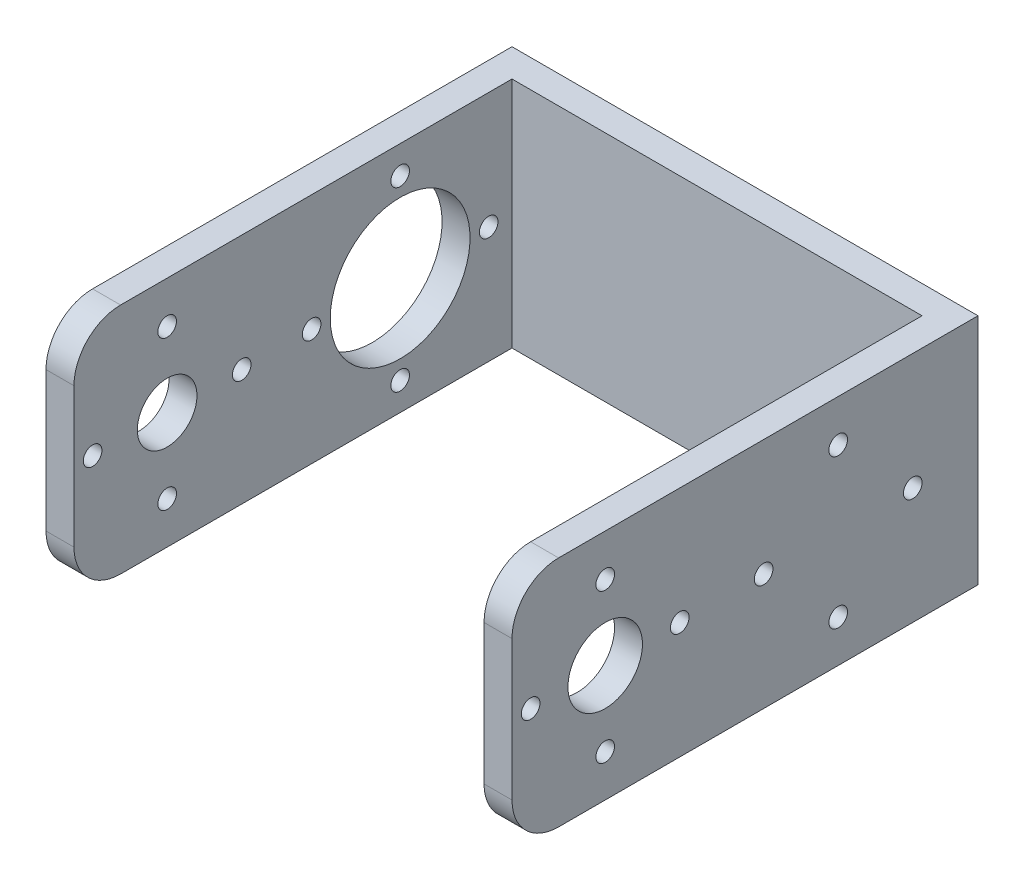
SolidWorks part; units mm, degrees
ref_plane "Front Plane" through (0, 0, 0) normal (0, 0, 1) x (1, 0, 0)
ref_plane "Top Plane" through (0, 0, 0) normal (0, 1, 0) x (1, 0, 0)
ref_plane "Right Plane" through (0, 0, 0) normal (1, 0, 0) x (0, 0, -1)
sketch "Sketch1" plane through (0, 0, 0) normal (0, 1, 0) x (1, 0, 0)
  line L0 (-23, 25) -> (27, 25)
  line L2 (27, 25) -> (27, -25)
  line L3 (27, -25) -> (24, -25)
  line L4 (24, -25) -> (24, 22)
  line L5 (24, 22) -> (-20, 22)
  line L6 (-20, 22) -> (-20, -25)
  line L7 (-20, -25) -> (-23, -25)
  line L8 (-23, -25) -> (-23, 25)
  dimension "D1" = 50
  dimension "D2" = 3
  dimension "D3" = 3
  dimension "D4" = 3
  dimension "D6" = 50
  dimension "D7" = 50
extrude "Boss-Extrude1" add sketch "Sketch1" along normal blind 25
sketch "Sketch2" plane through (-23, 0, 0) normal (-1, 0, 0) x (0, 0, 1)
  line L0 (-25, 12.5) -> (25, 12.5) construction
  line L1 (15, 25) -> (15, 0) construction
  line L2 (-25, 0) -> (25, 0) construction
  line L3 (-25, 25) -> (-25, 0) construction
  line L6 (25, 25) -> (25, 0) construction
  line L7 (-10, 25) -> (-10, 0) construction
  line L8 (-25, 25) -> (25, 25) construction
  circle A2 centre (-10, 12.5) radius 7.5
  circle A3 centre (-10, 22) radius 1
  circle A4 centre (-0.5, 12.5) radius 1
  circle A5 centre (-10, 3) radius 1
  circle A6 centre (-19.5, 12.5) radius 1
  circle A7 centre (15, 12.5) radius 3.2
  circle A8 centre (15, 20.5) radius 1
  circle A9 centre (23, 12.5) radius 1
  circle A10 centre (15, 4.5) radius 1
  circle A11 centre (7, 12.5) radius 1
  point P37 (15, 12.5)
  dimension "D2" = 15
  dimension "D3" = 15
  dimension "D8" = 6.4
  dimension "D9" = 2
  dimension "D10" = 2
  dimension "D11" = 2
  dimension "D12" = 8
  dimension "D4" = 15
  dimension "D5" = 9.5
  dimension "D6" = 10
  dimension "D7" = 9.5
  dimension "D13" = 4
extrude "Cut-Extrude1" cut sketch "Sketch2" against normal up to next
sketch "Sketch4" plane through (27, 0, 0) normal (1, 0, 0) x (0, 0, -1)
  line L0 (-25, 12.5) -> (25, 12.5) construction
  line L1 (-15, 25) -> (-15, 0) construction
  line L2 (-15, 22.5) -> (-15, -27.5) construction
  line L3 (-25, 25) -> (-25, 0) construction
  line L4 (-5, 12.5) -> (-55, 12.5) construction
  line L5 (-15, 2.5) -> (-15, 52.5) construction
  line L6 (25, 25) -> (25, 0) construction
  line L7 (10, 25) -> (10, 0) construction
  line L8 (-25, 25) -> (25, 25) construction
  line L9 (-25, 0) -> (25, 0) construction
  circle A0 centre (10, 20.5) radius 1
  circle A1 centre (18, 12.5) radius 1
  circle A2 centre (2, 12.5) radius 1
  circle A3 centre (10, 4.5) radius 1
  circle A4 centre (-15, 12.5) radius 4
  circle A5 centre (-15, 20.5) radius 1
  circle A6 centre (-7, 12.5) radius 1
  circle A7 centre (-15, 4.5) radius 1
  circle A8 centre (-23, 12.5) radius 1
  point P41 (-15, 12.5)
  dimension "D5" = 2
  dimension "D6" = 2
  dimension "D7" = 8
  dimension "D8" = 2
  dimension "D9" = 2
  dimension "D11" = 8
  dimension "D12" = 2
  dimension "D13" = 8
  dimension "D1" = 15
  dimension "D2" = 8
  dimension "D3" = 8
  dimension "D4" = 8
  dimension "D10" = 10
  dimension "D14" = 4
extrude "Cut-Extrude2" cut sketch "Sketch4" against normal up to next
fillet "Fillet1" radius 5 4 edges at (25.5, 0, 25) (25.5, 25, 25) (-21.5, 0, 25) (-21.5, 25, 25)
